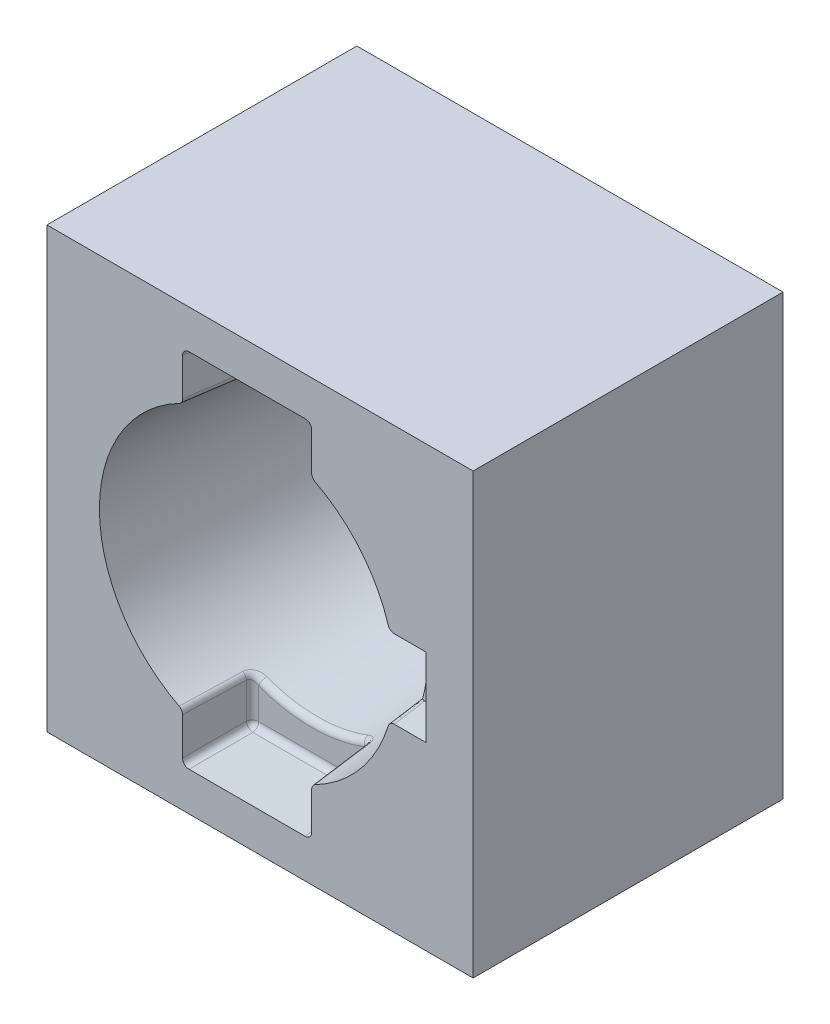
SolidWorks part; units mm, degrees
ref_plane "Plan de face" through (0, 0, 0) normal (0, 0, 1) x (1, 0, 0)
ref_plane "Plan de dessus" through (0, 0, 0) normal (0, 1, 0) x (1, 0, 0)
ref_plane "Plan de droite" through (0, 0, 0) normal (1, 0, 0) x (0, 0, -1)
sketch "Esquisse1" plane through (0, 0, 0) normal (0, 0, 1) x (1, 0, 0)
  line L1 (-141.2406, 170) -> (188.7594, 170)
  line L2 (-141.2406, 170) -> (-141.2406, -170)
  line L3 (-141.2406, -170) -> (188.7594, -170)
  line L4 (188.7594, 170) -> (188.7594, -170)
  dimension "D1" = 340
  dimension "D2" = 330
  dimension "D3" = 175
  dimension "D4" = 170
extrude "Boss.-Extru.1" add sketch "Esquisse1" against normal blind 240
other "Empreinte1"
other "modèle<2>@Moyeu de roue1"
other "noyau_intérieur<3>@Moyeu de roue1"
